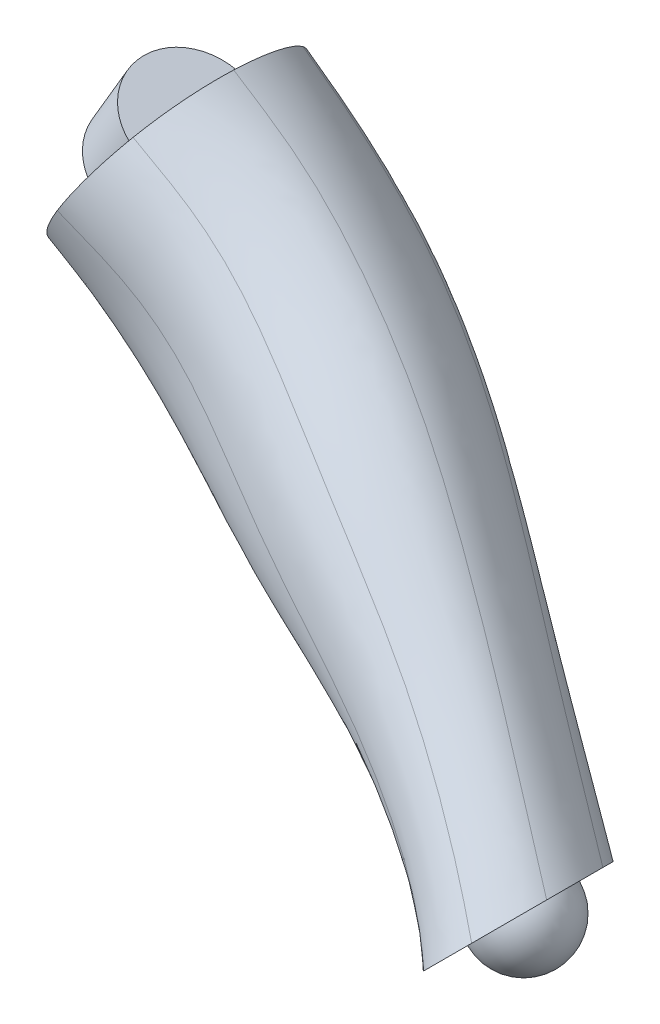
SolidWorks part; units mm, degrees
ref_plane "Front Plane" through (0, 0, 0) normal (0, 0, 1) x (1, 0, 0)
ref_plane "Top Plane" through (0, 0, 0) normal (0, 1, 0) x (1, 0, 0)
ref_plane "Right Plane" through (0, 0, 0) normal (1, 0, 0) x (0, 0, -1)
imported_body "Stock-Source-1"
ref_plane "Plane1" through (0, 0, 81.28) normal (0, 0, 1) x (1, 0, 0)
sketch "Sketch1" plane through (0, 0, 81.28) normal (0, 0, 1) x (1, 0, 0)
  line L0 (362.0611, 3955.187) -> (374.9258, 3977.0881)
  line L1 (356.3164, 3945.4071) -> (348.8378, 3932.6753) construction
  line L3 (362.0611, 3955.187) -> (343.8933, 3965.8587)
  line L4 (343.8933, 3965.8587) -> (356.758, 3987.7598)
  line L5 (356.758, 3987.7598) -> (374.9258, 3977.0881)
  dimension "D1" = 21.0702
  dimension "D2" = 25.4
revolve "Revolve1" add sketch "Sketch1" angle 360 about L0
ref_plane "Plane3" through (0, 0, 142.24) normal (0, 0, 1) x (1, 0, 0)
sketch "Sketch3" plane through (0, 0, 142.24) normal (0, 0, 1) x (1, 0, 0)
  line L0 (545.0311, 3834.1452) -> (568.732, 3857.8461)
  line L2 (540.1466, 3829.2607) -> (549.9156, 3839.0296) construction
  line L3 (564.8614, 3853.9754) -> (572.6026, 3861.7167) construction
  arc A0 (568.732, 3857.8461) -> (545.0311, 3834.1452) centre (556.8816, 3845.9956) cw
revolve "Revolve3" add sketch "Sketch3" angle 360 about L0
